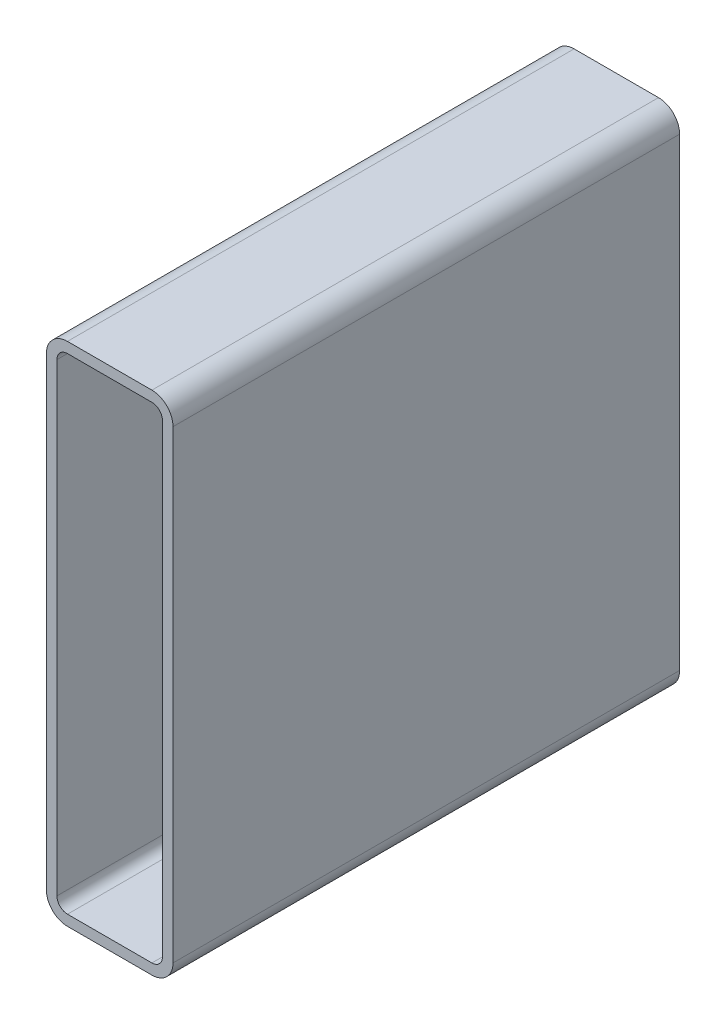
SolidWorks part; units mm, degrees
ref_plane "Front Plane" through (0, 0, 0) normal (0, 0, 1) x (1, 0, 0)
ref_plane "Top Plane" through (0, 0, 0) normal (0, 1, 0) x (1, 0, 0)
ref_plane "Right Plane" through (0, 0, 0) normal (1, 0, 0) x (0, 0, -1)
sketch "Sketch1" plane through (0, 0, 0) normal (0, 0, 1) x (1, 0, 0)
sketch_block_instance "HSS12x3x0.250-1"
sketch_block "HSS12x3x0.250"
extrude "Boss-Extrude1" add sketch "Sketch1" along normal blind 304.8
